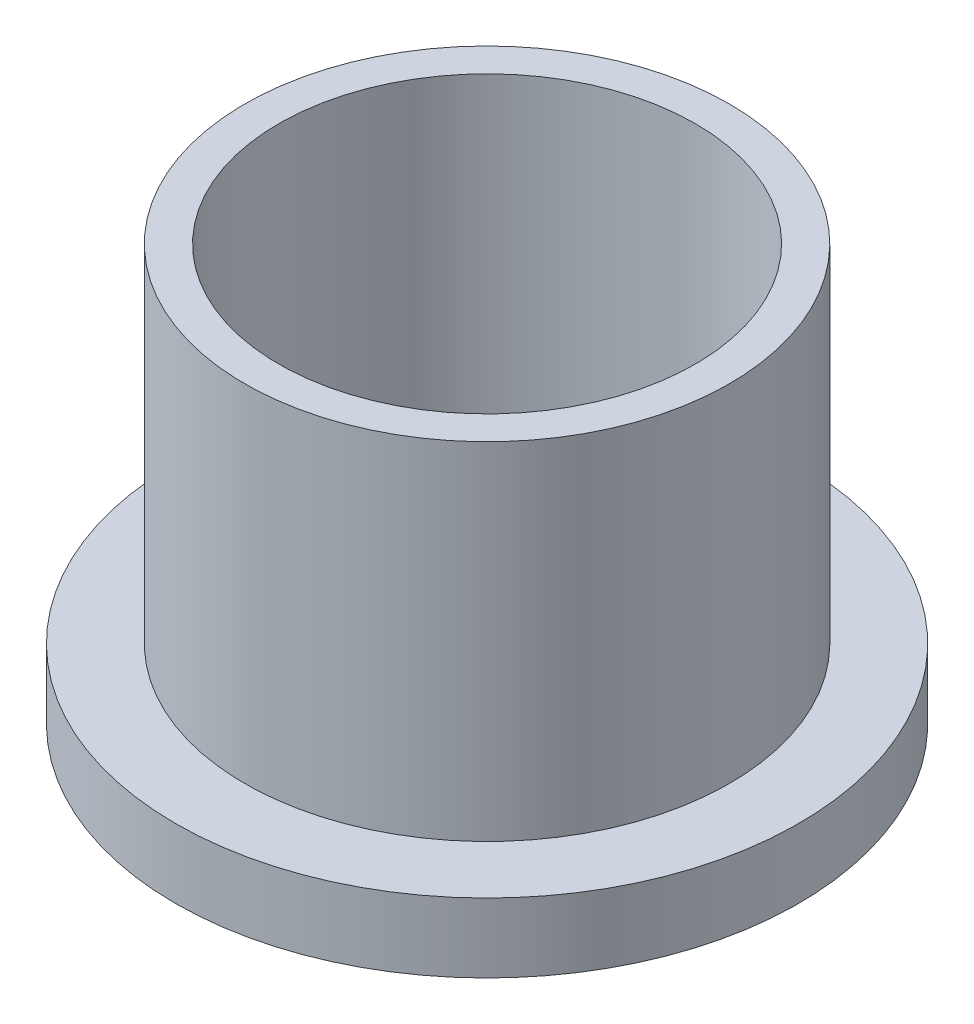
SolidWorks part; units mm, degrees
ref_plane "Front" through (0, 0, 0) normal (0, 0, 1) x (1, 0, 0)
ref_plane "Top" through (0, 0, 0) normal (0, 1, 0) x (1, 0, 0)
ref_plane "Right" through (0, 0, 0) normal (1, 0, 0) x (0, 0, -1)
sketch "Sketch1" plane through (0, 0, 0) normal (0, 1, 0) x (1, 0, 0)
  circle A0 centre (0, 0) radius 9.5504
  circle A1 centre (0, 0) radius 11.1125
  circle A2 centre (0, 0) radius 14.2875
  dimension "ID" = 19.1008
  dimension "OD" = 22.225
  dimension "FlangeOD" = 28.575
sketch "Sketch2" plane through (0, 0, 0) normal (0, 1, 0) x (1, 0, 0)
  circle A0 centre (0, 0) radius 9.5504 construction
  circle A1 centre (0, 0) radius 11.1125 construction
  circle A2 centre (0, 0) radius 9.5504
  circle A3 centre (0, 0) radius 11.1125
extrude "Boss-Extrude1" add sketch "Sketch2" along normal blind 19.05
sketch "Sketch3" plane through (0, 0, 0) normal (0, 1, 0) x (1, 0, 0)
  circle A0 centre (0, 0) radius 14.2875 construction
  circle A1 centre (0, 0) radius 11.1125 construction
  circle A2 centre (0, 0) radius 14.2875
  circle A3 centre (0, 0) radius 11.1125
extrude "Boss-Extrude2" add sketch "Sketch3" along normal blind 3.175
